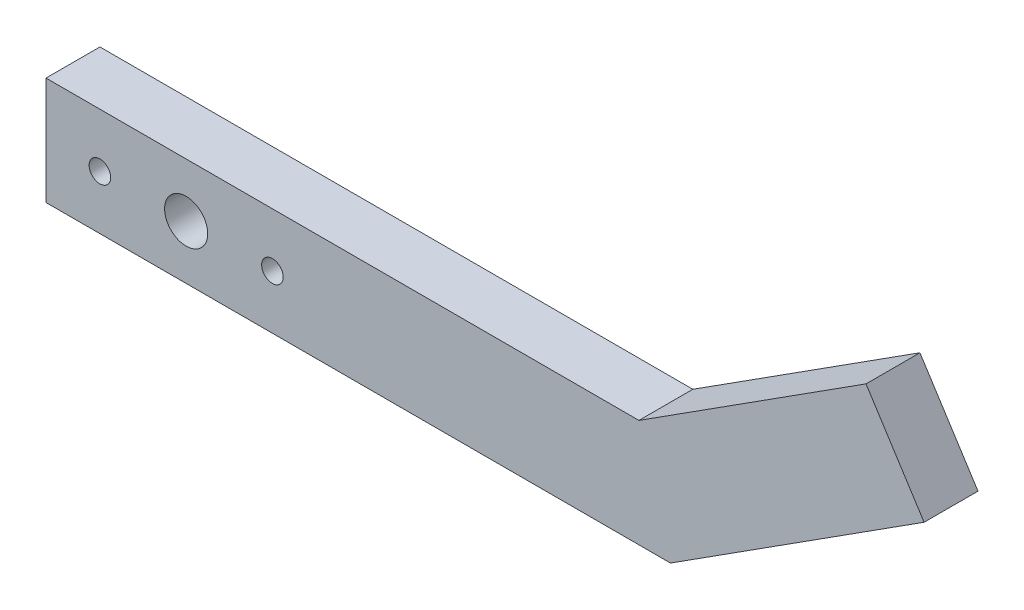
SolidWorks part; units mm, degrees
ref_plane "Front Plane" through (0, 0, 0) normal (0, 0, 1) x (1, 0, 0)
ref_plane "Top Plane" through (0, 0, 0) normal (0, 1, 0) x (1, 0, 0)
ref_plane "Right Plane" through (0, 0, 0) normal (1, 0, 0) x (0, 0, -1)
sketch "Sketch1" plane through (0, 0, 0) normal (0, 0, 1) x (1, 0, 0)
  line L0 (25, 5) -> (46.064, 18.4651)
  line L1 (-30, 5) -> (25, 5)
  line L2 (-30, 5) -> (-30, -5)
  line L3 (-30, -5) -> (20, -5)
  line L5 (46.064, 18.4651) -> (51.45, 10.0395)
  line L6 (51.45, 10.0395) -> (27.9231, -5)
  line L7 (20, -5) -> (27.9231, -5)
  dimension "D1" = 10
  dimension "D2" = 25
  dimension "D4" = 50
extrude "Boss-Extrude1" add sketch "Sketch1" along normal blind 5
sketch "Sketch2" plane through (0, 0, 5) normal (0, 0, 1) x (1, 0, 0)
  line L0 (-30, 5) -> (-30, -5) construction
  circle A0 centre (-17, 0) radius 2
  circle A1 centre (-25, 0) radius 1
  circle A2 centre (-9, 0) radius 1
  dimension "D1" = 5
  dimension "D2" = 8
  dimension "D3" = 8
extrude "Cut-Extrude1" cut sketch "Sketch2" against normal blind 5
